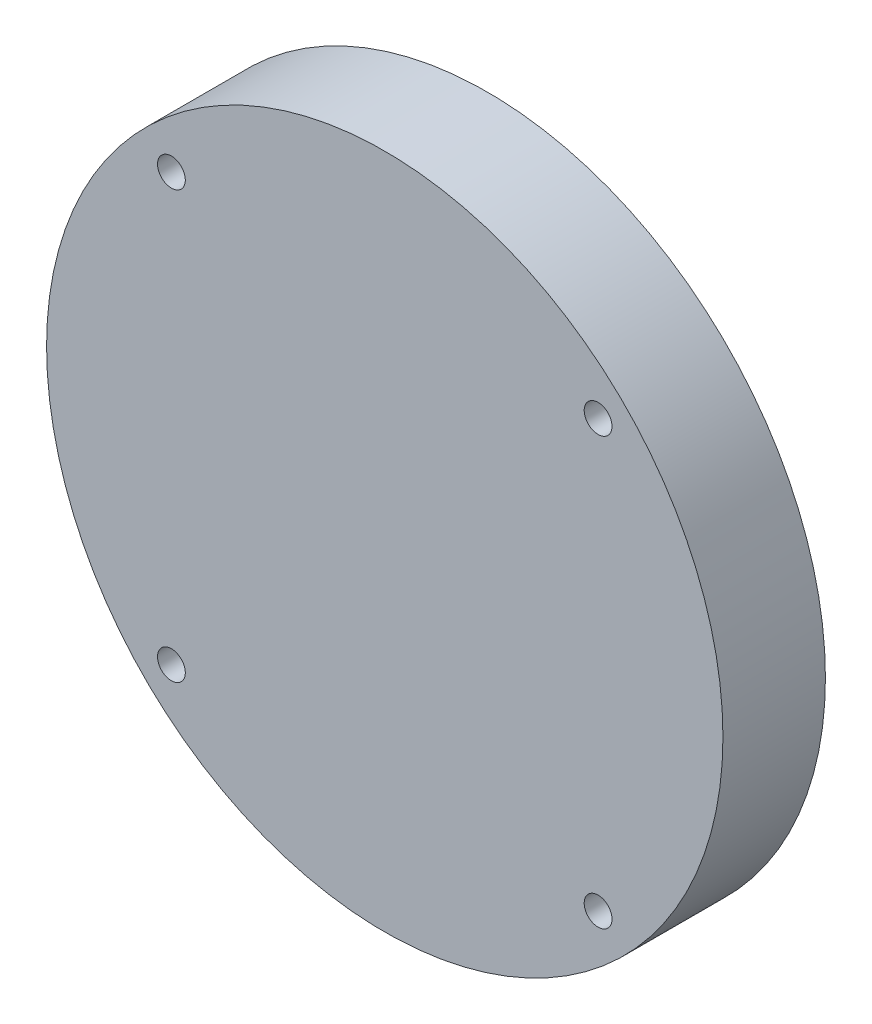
SolidWorks part; units mm, degrees
ref_plane "Front Plane" through (0, 0, 0) normal (0, 0, 1) x (1, 0, 0)
ref_plane "Top Plane" through (0, 0, 0) normal (0, 1, 0) x (1, 0, 0)
ref_plane "Right Plane" through (0, 0, 0) normal (1, 0, 0) x (0, 0, -1)
sketch "Sketch1" plane through (0, 0, 0) normal (0, 0, 1) x (1, 0, 0)
  circle A0 centre (0, 0) radius 52.3875
  dimension "D1" = 104.775
extrude "Boss-Extrude1" add sketch "Sketch1" along normal blind 15.875
hole_wizard "#8 Clearance Hole1" positions "Sketch6" profile "Sketch5" hole size "#8" standard "ANSI Inch"
sketch "Sketch6" plane through (0, 0, 15.875) normal (0, 0, 1) x (1, 0, 0)
  line L0 (-33.0473, 33.0473) -> (0, 0) construction
  line L1 (0, 0) -> (33.0473, 33.0473) construction
  line L4 (33.0473, -33.0473) -> (0, 0) construction
  line L5 (0, 0) -> (-33.0473, -33.0473) construction
  line L7 (8.7312, 0) -> (-8.7312, 0) construction
  circle A0 centre (0, 0) radius 46.736
  circle A1 centre (0, 0) radius 44.45
  point P5 (-33.0473, 33.0473)
  point P7 (33.0473, 33.0473)
  point P9 (33.0473, -33.0473)
  point P11 (-33.0473, -33.0473)
  dimension "D1" = 93.472
  dimension "D2" = 88.9
  dimension "D3" = 45
sketch "Sketch5" plane through (-33.0473, 33.0473, 15.875) normal (1, 0, 0) x (0, -1, 0)
  line L0 (0, 0) -> (0, 15.875)
  line L1 (0, 15.875) -> (2.1526, 15.875)
  line L2 (2.1526, 15.875) -> (2.1526, 0)
  line L5 (2.1526, 0) -> (0, 0)
  line L11 (0, -6.35) -> (0, 107.95) construction
  dimension "Thru Hole Dia." = 4.3053
  dimension "Thru Hole Depth" = 15.875
